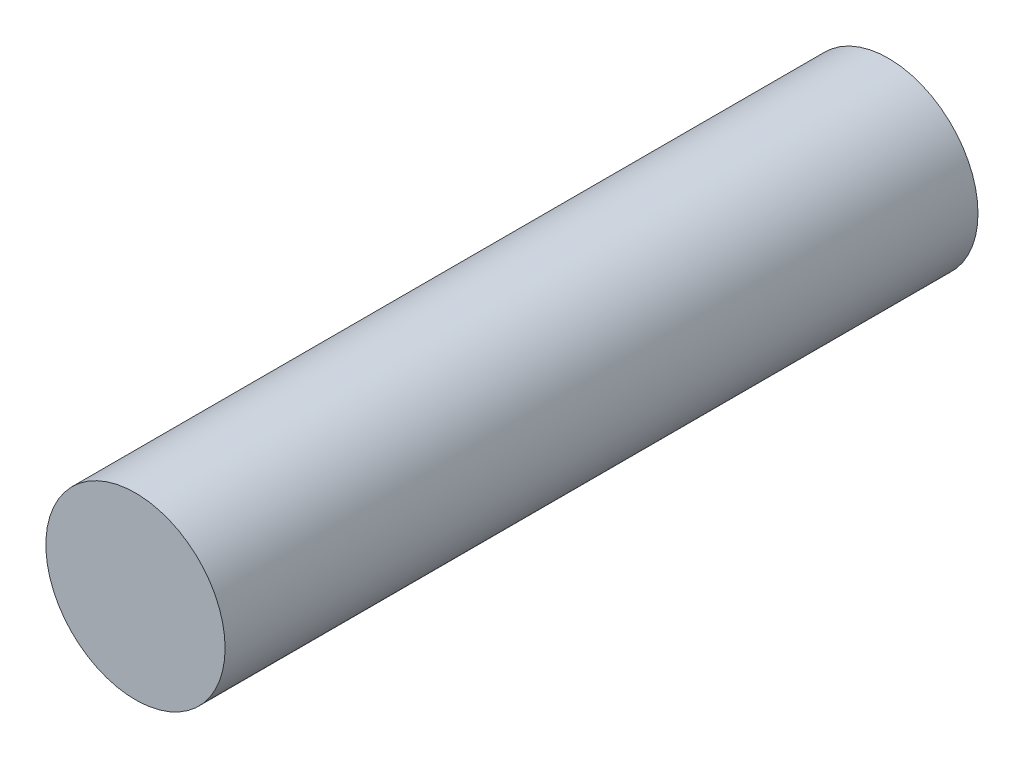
SolidWorks part; units mm, degrees
ref_plane "Face" through (0, 0, 0) normal (0, 0, 1) x (1, 0, 0)
ref_plane "Dessus" through (0, 0, 0) normal (0, 1, 0) x (1, 0, 0)
ref_plane "Droite" through (0, 0, 0) normal (1, 0, 0) x (0, 0, -1)
sketch "EsqCylindre" plane through (0, 0, 0) normal (0, 0, 1) x (1, 0, 0)
  circle A0 centre (0, 0) radius 10
  dimension "Diametre" = 20
extrude "Cylindre" add sketch "EsqCylindre" against normal blind 84
